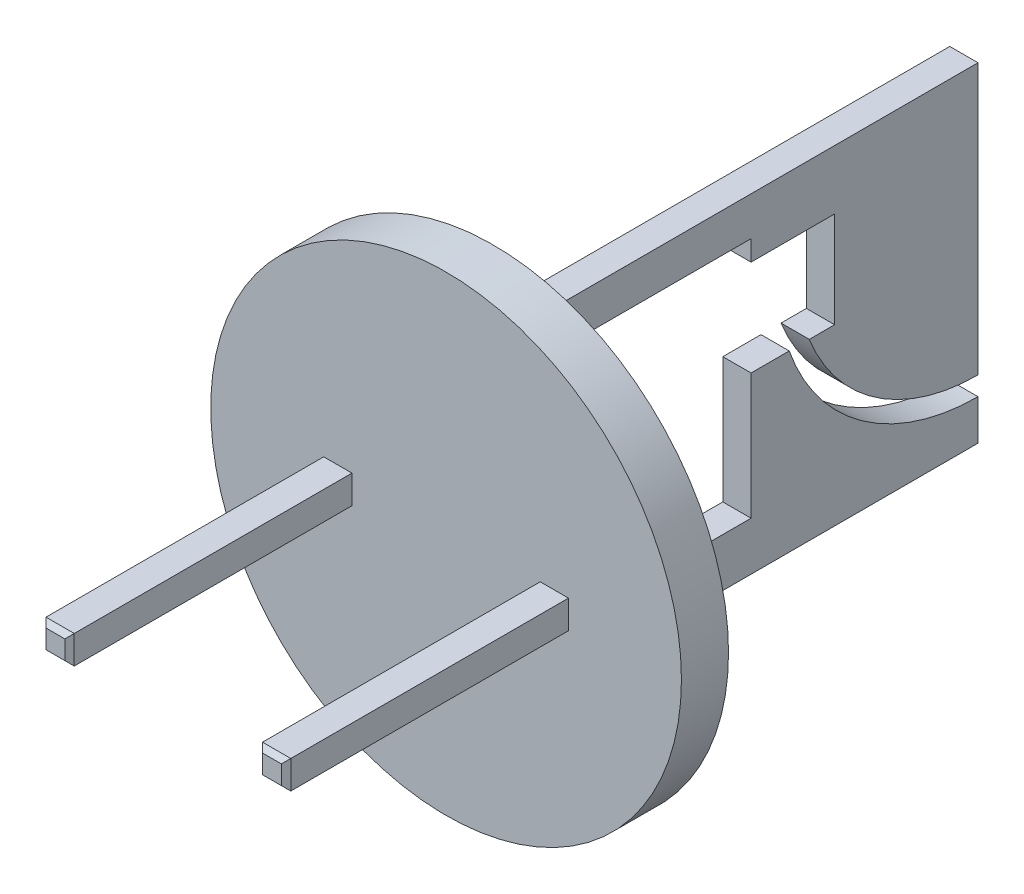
SolidWorks part; units mm, degrees
ref_plane "Plan de face" through (0, 0, 0) normal (0, 0, 1) x (1, 0, 0)
ref_plane "Plan de dessus" through (0, 0, 0) normal (0, 1, 0) x (1, 0, 0)
ref_plane "Plan de droite" through (0, 0, 0) normal (1, 0, 0) x (0, 0, -1)
sketch "Esquisse2" plane through (0, 0, 0) normal (0, 0, 1) x (1, 0, 0)
  circle A0 centre (0, 0) radius 2.5 construction
  circle A3 centre (0, 0) radius 2.5
extrude "Extrusion1" add sketch "Esquisse2" against normal up to surface (0.5 mm away)
sketch "Esquisse3" plane through (0, 0, -0.5) normal (0, 0, -1) x (-1, 0, 0)
  line L1 (-0.15, 1.75) -> (0.15, 1.75)
  line L2 (-0.15, 1.75) -> (-0.15, -1.75)
  line L3 (-0.15, -1.75) -> (0.15, -1.75)
  line L4 (0.15, 1.75) -> (0.15, -1.75)
  dimension "D1" = 0.15
  dimension "D2" = 0.15
  dimension "D3" = 1.75
  dimension "D4" = 1.75
extrude "Extrusion2" add sketch "Esquisse3" along normal blind 5
sketch "Esquisse4" plane through (0.15, 0, 0) normal (1, 0, 0) x (0, 0, -1)
  line L0 (3.708, 0.1015) -> (3.9769, 0.1015)
  line L1 (0.5, -2.5) -> (0.5, 2.5) construction
  line L2 (0.5, 1.337) -> (3.0894, 1.337)
  line L3 (0.5, 1.337) -> (0.5, -1.2346)
  line L4 (0.5, -1.2346) -> (3.0894, -1.2346)
  line L5 (3.0894, 1.337) -> (3.0894, 1.1208)
  line L7 (5.5, -1.1219) -> (5.5, -1.3219)
  line L9 (3.0894, 0.1015) -> (3.0894, -1.2346)
  line L11 (3.0894, 0.1015) -> (3.4948, 0.1015)
  line L12 (3.9769, 1.1208) -> (3.9769, 0.1015)
  line L13 (3.0894, 1.1208) -> (3.9769, 1.1208)
  line L14 (5.5, 1.75) -> (5.5, -1.75) construction
  arc A0 (3.708, 0.1015) -> (5.5, -1.1219) centre (5.5, 0.8022) ccw
  arc A1 (3.4948, 0.1015) -> (5.5, -1.3219) centre (5.5, 0.8022) ccw
  circle A2 centre (5.5, 0.8022) radius 2.1241 construction
  circle A3 centre (5.5, 0.8022) radius 1.9241 construction
  dimension "D1" = 0.2
extrude "Enlèv. mat.-Extru.2" cut sketch "Esquisse4" against normal through all
sketch "Esquisse5" plane through (0, 0, 0) normal (0, 0, 1) x (1, 0, 0)
  line L0 (0, 1.0031) -> (0, -1.0758) construction
  line L1 (-1.3, 0.15) -> (-1, 0.15)
  line L2 (-1.3, 0.15) -> (-1.3, -0.15)
  line L3 (-1.3, -0.15) -> (-1, -0.15)
  line L4 (-1, 0.15) -> (-1, -0.15)
  line L5 (1.3, 0.15) -> (1.3, -0.15)
  line L6 (1.3, 0.15) -> (1, 0.15)
  line L7 (1, 0.15) -> (1, -0.15)
  line L8 (1.3, -0.15) -> (1, -0.15)
  dimension "D1" = 1
  dimension "D2" = 0.15
  dimension "D3" = 0.15
  dimension "D4" = 1.3
extrude "Extrusion3" add sketch "Esquisse5" along normal blind 3
chamfer "Chanfrein1" distance 0.05 angle 45 8 edges at (1.3, 0, 3) (1.15, -0.15, 3) (1, 0, 3) (1.15, 0.15, 3) (-1, 0, 3) (-1.15, -0.15, 3) (-1.3, 0, 3) (-1.15, 0.15, 3)
